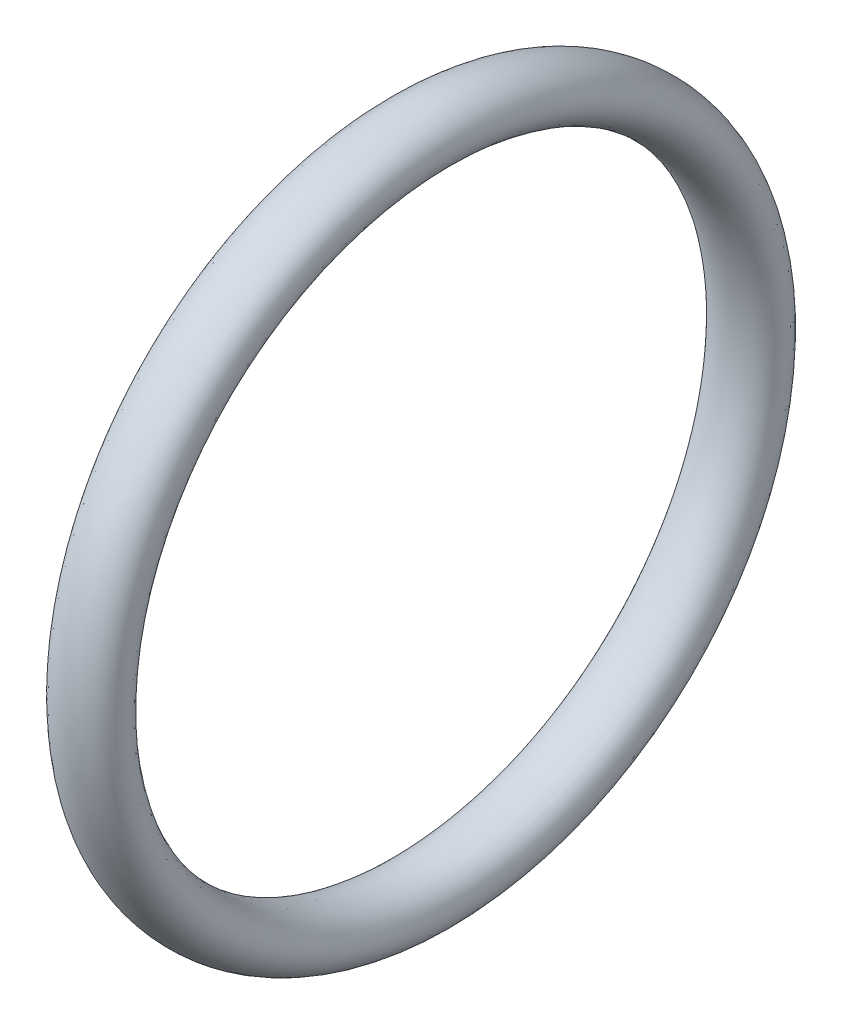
SolidWorks part; units mm, degrees
ref_plane "Face" through (0, 0, 0) normal (0, 0, 1) x (1, 0, 0)
ref_plane "Dessus" through (0, 0, 0) normal (0, 1, 0) x (1, 0, 0)
ref_plane "Droite" through (0, 0, 0) normal (1, 0, 0) x (0, 0, -1)
sketch "Esquisse2" plane through (0, 0, 0) normal (0, 0, 1) x (1, 0, 0)
  line L0 (0, 0) -> (22.1264, 0) construction
  line L1 (0, 0) -> (0, 0.5175) construction
  ellipse E0 centre (0, 18.5) end of major axis (2, 18.5) minor radius 1.5
  dimension "D1" = 4
  dimension "D2" = 3
  dimension "D3" = 18.5
  dimension "D4" = 18.5
revolve "Révolution1" add sketch "Esquisse2" angle 360 about L0
